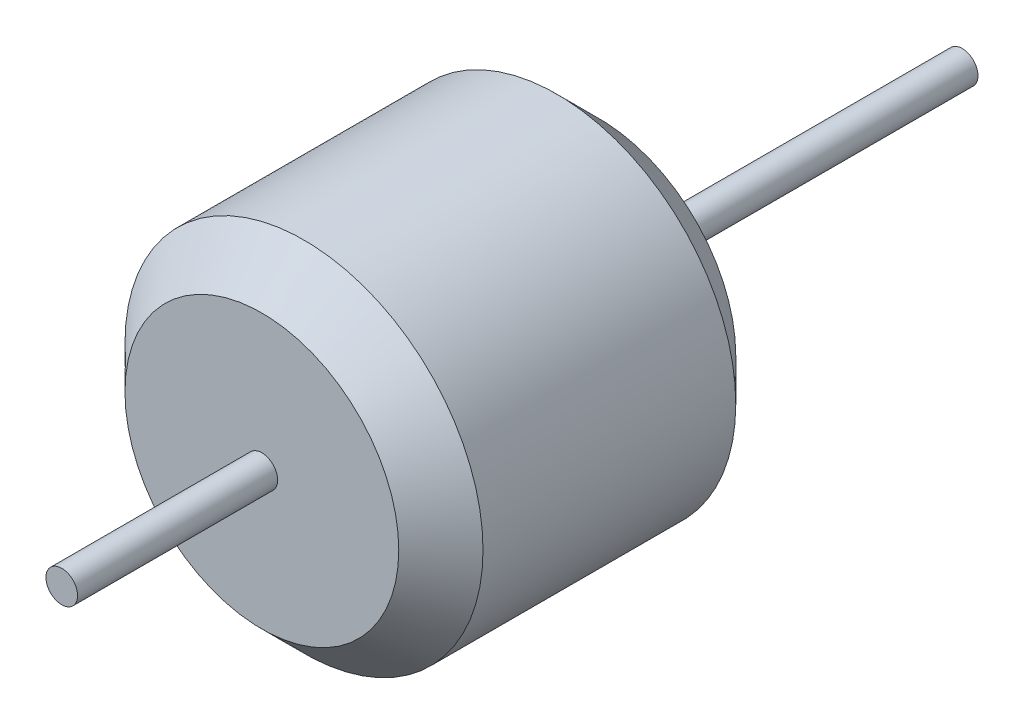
SolidWorks part; units mm, degrees
ref_plane "Plan de face" through (0, 0, 0) normal (0, 0, 1) x (1, 0, 0)
ref_plane "Plan de dessus" through (0, 0, 0) normal (0, 1, 0) x (1, 0, 0)
ref_plane "Plan de droite" through (0, 0, 0) normal (1, 0, 0) x (0, 0, -1)
sketch "Esquisse1" plane through (0, 0, 0) normal (0, 0, 1) x (1, 0, 0)
  circle A0 centre (0, 0) radius 17
  dimension "D1" = 34
extrude "Boss.-Extru.1" add sketch "Esquisse1" along normal blind 32
chamfer "Chanfrein1" distance 4 angle 45 2 edges at (17, 0, 0) (17, 0, 32)
sketch "Esquisse2" plane through (0, 0, 32) normal (0, 0, 1) x (1, 0, 0)
  circle A0 centre (0, 0) radius 1.5
  dimension "D1" = 3
extrude "Boss.-Extru.2" add sketch "Esquisse2" along normal blind 19 and the other way blind 66.5
